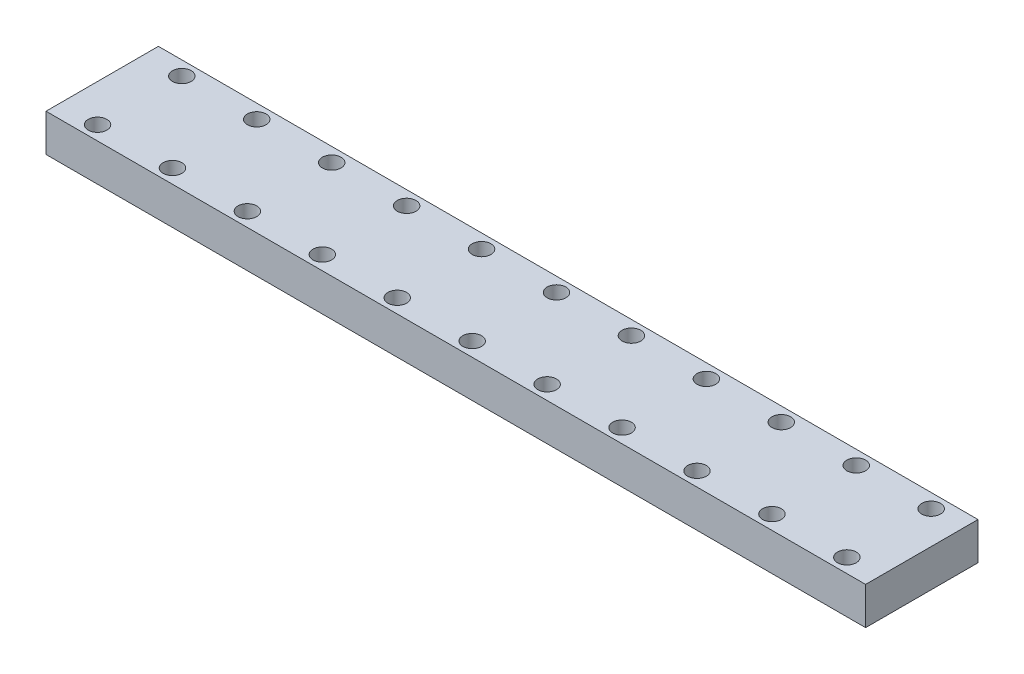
SolidWorks part; units mm, degrees
ref_plane "前视基准面" through (0, 0, 0) normal (0, 0, 1) x (1, 0, 0)
ref_plane "上视基准面" through (0, 0, 0) normal (0, 1, 0) x (1, 0, 0)
ref_plane "右视基准面" through (0, 0, 0) normal (1, 0, 0) x (0, 0, -1)
sketch "草图1" plane through (0, 0, 0) normal (0, 1, 0) x (1, 0, 0)
  line L1 (-17.9765, 7.3882) -> (157.0235, 7.3882)
  line L2 (-17.9765, 7.3882) -> (-17.9765, -16.6118)
  line L3 (-17.9765, -16.6118) -> (157.0235, -16.6118)
  line L4 (157.0235, 7.3882) -> (157.0235, -16.6118)
  circle A0 centre (-9.9765, 4.3882) radius 2
  circle A1 centre (6.0235, 4.3882) radius 2
  circle A2 centre (22.0235, 4.3882) radius 2
  circle A3 centre (38.0235, 4.3882) radius 2
  circle A4 centre (54.0235, 4.3882) radius 2
  circle A5 centre (70.0235, 4.3882) radius 2
  circle A6 centre (86.0235, 4.3882) radius 2
  circle A7 centre (102.0235, 4.3882) radius 2
  circle A8 centre (118.0235, 4.3882) radius 2
  circle A9 centre (134.0235, 4.3882) radius 2
  circle A10 centre (150.0235, 4.3882) radius 2
  circle A11 centre (-9.9765, -13.6118) radius 2
  circle A12 centre (6.0235, -13.6118) radius 2
  circle A13 centre (22.0235, -13.6118) radius 2
  circle A14 centre (38.0235, -13.6118) radius 2
  circle A15 centre (54.0235, -13.6118) radius 2
  circle A16 centre (70.0235, -13.6118) radius 2
  circle A17 centre (86.0235, -13.6118) radius 2
  circle A18 centre (102.0235, -13.6118) radius 2
  circle A19 centre (118.0235, -13.6118) radius 2
  circle A20 centre (134.0235, -13.6118) radius 2
  circle A21 centre (150.0235, -13.6118) radius 2
  dimension "D3" = 3
  dimension "D1" = 24
  dimension "D2" = 175
  dimension "D4" = 8
  dimension "D5" = 2
  dimension "D6" = 2
  dimension "D7" = 2
  dimension "D8" = 2
  dimension "D9" = 2
extrude "凸台-拉伸1" add sketch "草图1" along normal blind 8
